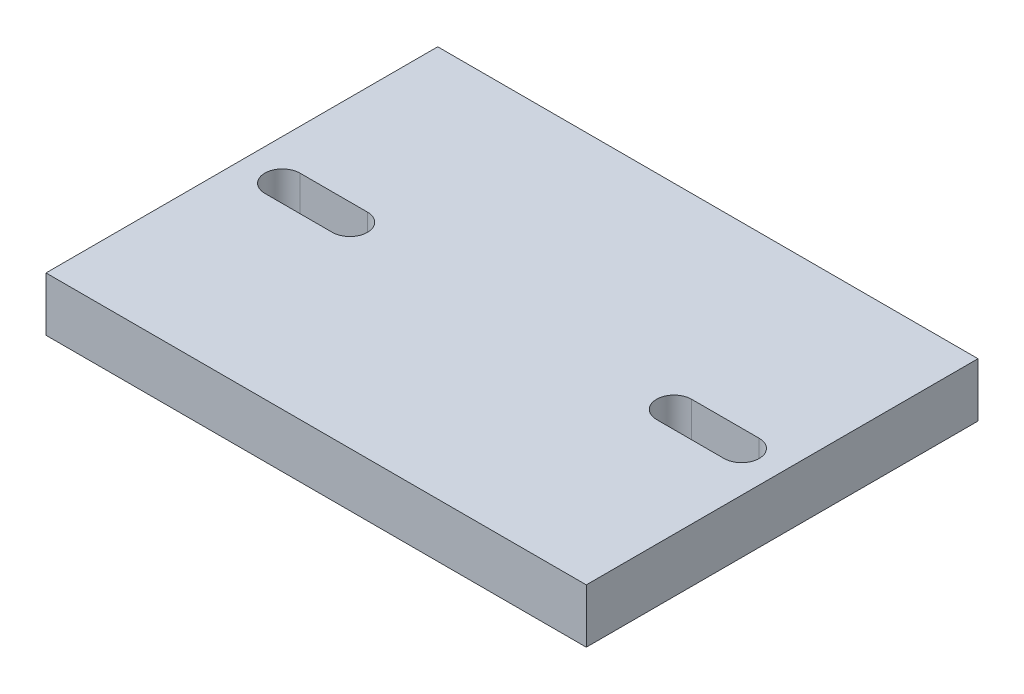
SolidWorks part; units mm, degrees
ref_plane "Спереди" through (0, 0, 0) normal (0, 0, 1) x (1, 0, 0)
ref_plane "Сверху" through (0, 0, 0) normal (0, 1, 0) x (1, 0, 0)
ref_plane "Справа" through (0, 0, 0) normal (1, 0, 0) x (0, 0, -1)
sketch "Эскиз2" plane through (0, 0, 0) normal (0, 0, 1) x (1, 0, 0)
  line L1 (-80, 0) -> (0, 0)
  line L2 (-80, 0) -> (-80, 8)
  line L3 (-80, 8) -> (0, 8)
  line L4 (0, 0) -> (0, 8)
  dimension "D1" = 8
  dimension "D2" = 80
extrude "Бобышка-Вытянуть2" add sketch "Эскиз2" along normal blind 58
sketch "Эскиз3" plane through (0, 8, 0) normal (0, 1, 0) x (1, 0, 0)
  line L1 (-74, -26.4) -> (-64, -26.4)
  line L2 (-80, -58) -> (-80, 0) construction
  line L3 (-74, -31.6) -> (-64, -31.6)
  line L4 (-80, -29) -> (50.7094, -29) construction
  line L5 (-80, -58) -> (-80, 0) construction
  line L6 (-40, -58) -> (-40, -17.0512) construction
  line L7 (0, -58) -> (-80, -58) construction
  line L8 (-6, -31.6) -> (-16, -31.6)
  line L9 (-6, -26.4) -> (-16, -26.4)
  arc A0 (-74, -26.4) -> (-74, -31.6) centre (-74, -29) ccw
  arc A1 (-64, -26.4) -> (-64, -31.6) centre (-64, -29) cw
  arc A2 (-16, -26.4) -> (-16, -31.6) centre (-16, -29) ccw
  arc A3 (-6, -26.4) -> (-6, -31.6) centre (-6, -29) cw
  dimension "D4" = 6
  dimension "D2" = 2.6
  dimension "D1" = 10
extrude "Вырез-Вытянуть1" cut sketch "Эскиз3" against normal through all
